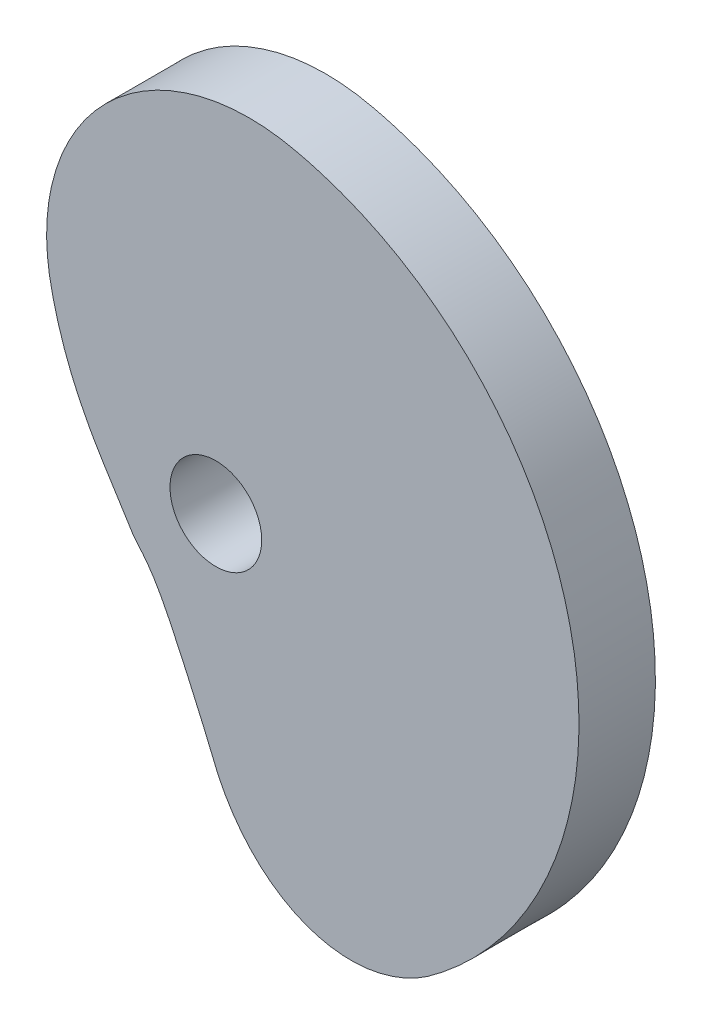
SolidWorks part; units mm, degrees
ref_plane "Face" through (0, 0, 0) normal (0, 0, 1) x (1, 0, 0)
ref_plane "Dessus" through (0, 0, 0) normal (0, 1, 0) x (1, 0, 0)
ref_plane "Droite" through (0, 0, 0) normal (1, 0, 0) x (0, 0, -1)
curve "Courbe1"
sketch "Esquisse1" plane through (0, 0, 0) normal (0, 0, 1) x (1, 0, 0)
  point P0 (-243.24, 399.51)
  dimension "D1" = 0
extrude "Extrusion1" add sketch "Esquisse1" along normal blind 20
sketch "Esquisse2" plane through (0, 0, 20) normal (0, 0, 1) x (1, 0, 0)
  circle A0 centre (-264.3966, 306.9083) radius 12
extrude "Enlèv. mat.-Extru.1" cut sketch "Esquisse2" against normal up to next
